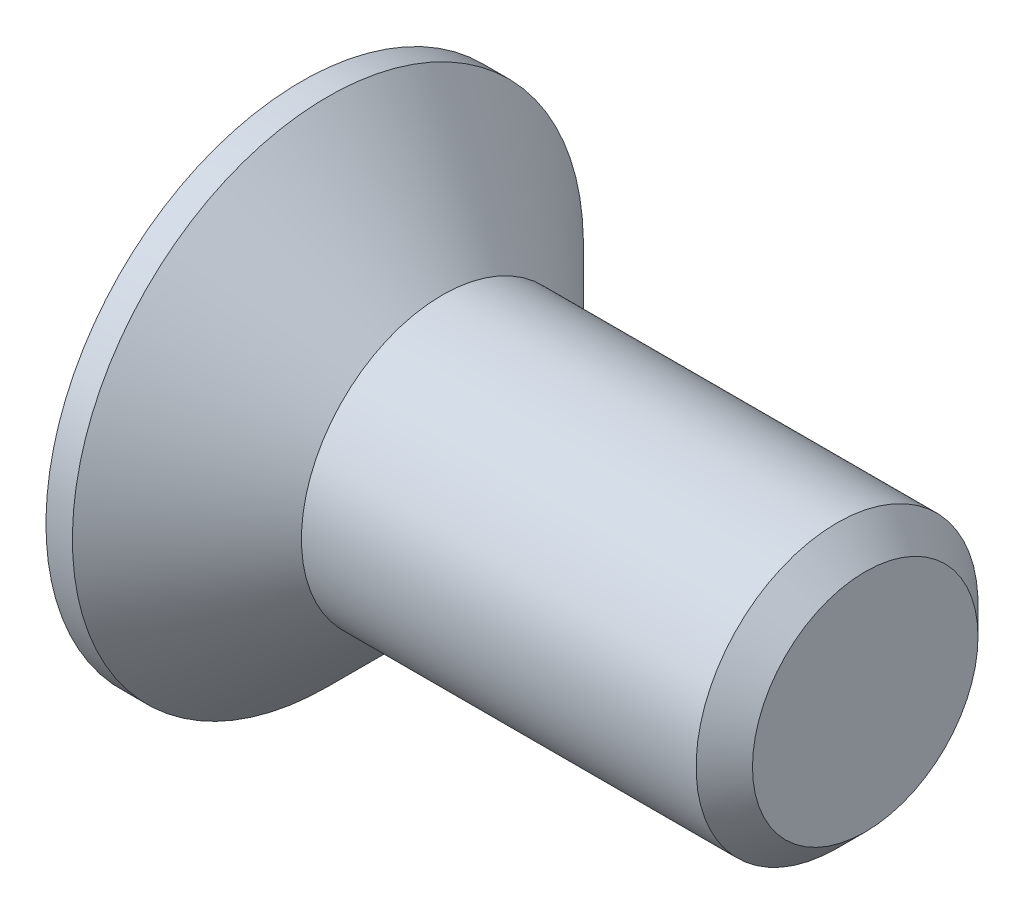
SolidWorks part; units mm, degrees
ref_plane "Front Plane" through (0, 0, 0) normal (0, 0, 1) x (1, 0, 0)
ref_plane "Top Plane" through (0, 0, 0) normal (0, 1, 0) x (1, 0, 0)
ref_plane "Right Plane" through (0, 0, 0) normal (1, 0, 0) x (0, 0, -1)
sketch "Sketch1" plane through (0, 0, 0) normal (0, 0, 1) x (1, 0, 0)
  line L1 (-4, 7.25) -> (-4, 0)
  line L2 (-4, 0) -> (12, 0)
  line L3 (12, 0) -> (12, 4)
  line L4 (12, 4) -> (0, 4)
  line L5 (-4, 7.25) -> (-3.25, 7.25)
  line L6 (-3.25, 7.25) -> (0, 4)
  dimension "D1" = 4
  dimension "D2" = 45
  dimension "D3" = 4
  dimension "D4" = 16
  dimension "D5" = 7.25
revolve "Revolve1" add sketch "Sketch1" angle 360 about L2
chamfer "Chamfer1" distance 0.8 angle 45 1 edges at (12, -4, 0)
sketch "Sketch2" plane through (-4, 0, 0) normal (-1, 0, 0) x (0, 0, 1)
  line L0 (-1.09, 4.35) -> (1.09, 4.35)
  line L1 (1.09, 4.35) -> (1.09, 1.09)
  line L2 (1.09, 1.09) -> (4.35, 1.09)
  line L3 (4.35, 1.09) -> (4.35, -1.09)
  line L4 (4.35, -1.09) -> (1.09, -1.09)
  line L5 (1.09, -1.09) -> (1.09, -4.35)
  line L6 (1.09, -4.35) -> (-1.09, -4.35)
  line L7 (-1.09, -4.35) -> (-1.09, -1.09)
  line L8 (-1.09, -1.09) -> (-4.35, -1.09)
  line L9 (-4.35, -1.09) -> (-4.35, 1.09)
  line L10 (-4.35, 1.09) -> (-1.09, 1.09)
  line L11 (-1.09, 1.09) -> (-1.09, 4.35)
  point P2 (0, 4.35)
  point P14 (0, -4.35)
  point P15 (4.35, 0)
  point P16 (-4.35, 0)
  dimension "D1" = 8.7
  dimension "D2" = 2.18
extrude "Cut-Extrude1" cut sketch "Sketch2" against normal blind 3.45
